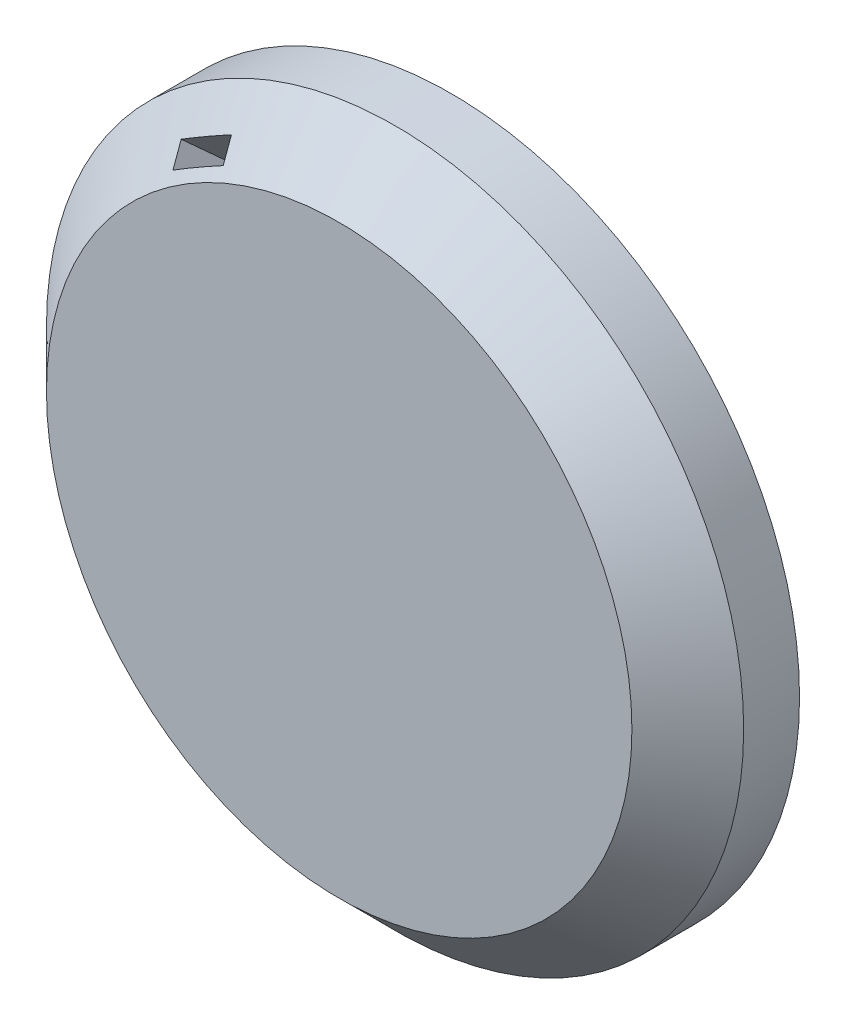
SolidWorks part; units mm, degrees
ref_plane "vorn" through (0, 0, 0) normal (0, 0, 1) x (1, 0, 0)
ref_plane "oben" through (0, 0, 0) normal (0, 1, 0) x (1, 0, 0)
ref_plane "rechts" through (0, 0, 0) normal (1, 0, 0) x (0, 0, -1)
sketch "Skizze1" plane through (0, 0, 0) normal (0, 0, 1) x (1, 0, 0)
  circle A0 centre (0, 0) radius 62.3893
extrude "Linear austragen1" add sketch "Skizze1" against normal blind 20
chamfer "Fase1" distance 10 angle 45 1 edges at (62.3893, 0, 0)
sketch "Skizze2" plane through (0, 0, 0) normal (0, 0, 1) x (1, 0, 0)
  line L0 (0, 0) -> (-26.1947, 45.3705) construction
  line L1 (0, 0) -> (0, 32.0342) construction
  line L2 (-94.0128, 6.2157) -> (56.3224, 93.0117) construction
  circle A0 centre (0, 0) radius 52.3893 construction
  dimension "D1" = 30
ref_plane "Ebene1" through (-26.1947, 45.3705, 0) normal (-0.5, 0.866, 0) x (-0.866, -0.5, 0)
ref_plane "Ebene2" through (-13.0973, 22.6852, 26.1947) normal (-0.3536, 0.6124, 0.7071) x (0.9354, 0.2315, 0.2673)
sketch "Skizze3" plane through (-13.0973, 22.6852, 26.1947) normal (-0.3536, 0.6124, 0.7071) x (0.9354, 0.2315, 0.2673)
  line L1 (-20.5822, 39.3574) -> (-9.3631, 39.3574)
  line L2 (-20.5822, 39.3574) -> (-20.5822, 44.4943)
  line L3 (-20.5822, 44.4943) -> (-9.3631, 44.4943)
  line L4 (-9.3631, 39.3574) -> (-9.3631, 44.4943)
extrude "Schnitt-Linear austragen1" [suppressed] cut sketch "Skizze3" against normal blind 10
sketch "Skizze4" plane through (-13.0973, 22.6852, 26.1947) normal (-0.3536, 0.6124, 0.7071) x (0.9354, 0.2315, 0.2673)
  line L0 (-19.6158, 34.3161) -> (-10.005, 38.2396)
  line L1 (-10.005, 38.2396) -> (-11.5859, 42.1121)
  line L2 (-11.5859, 42.1121) -> (-21.1967, 38.1886)
  line L3 (-21.1967, 38.1886) -> (-19.6158, 34.3161)
  line L4 (0, 0) -> (-14.0016, 34.2969) construction
  line L5 (-14.8104, 36.2779) -> (0, 0) construction
extrude "Schnitt-Linear austragen2" cut sketch "Skizze4" against normal blind 12
